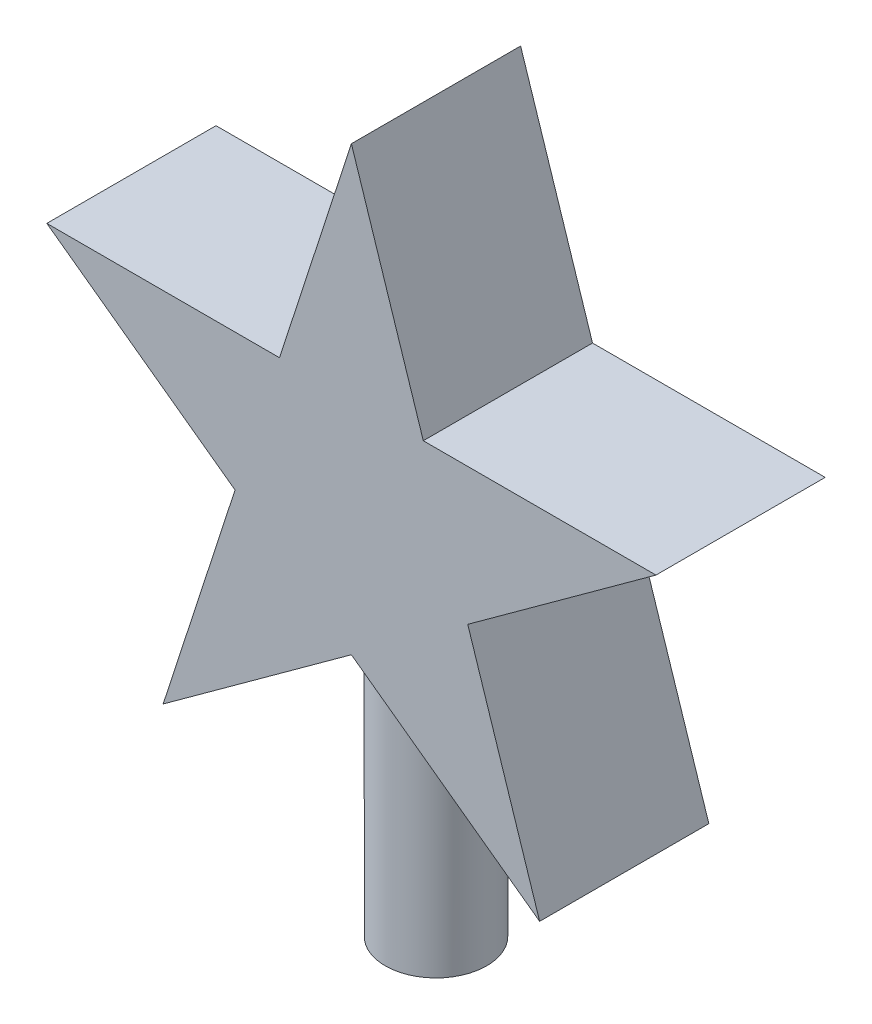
SolidWorks part; units mm, degrees
ref_plane "前视基准面" through (0, 0, 0) normal (0, 0, 1) x (1, 0, 0)
ref_plane "上视基准面" through (0, 0, 0) normal (0, 1, 0) x (1, 0, 0)
ref_plane "右视基准面" through (0, 0, 0) normal (1, 0, 0) x (0, 0, -1)
sketch "草图1" plane through (0, 0, 0) normal (0, 0, 1) x (1, 0, 0)
  line L0 (0, 0) -> (0, 31.7923) construction
  line L1 (-9, 2.9243) -> (-2.1246, 2.9243)
  line L7 (9, 2.9243) -> (3.4377, -1.117)
  line L8 (0, 9.4632) -> (-2.1246, 2.9243)
  line L9 (-9, 2.9243) -> (-3.4377, -1.117)
  line L10 (0, 9.4632) -> (2.1246, 2.9243)
  line L11 (2.1246, 2.9243) -> (9, 2.9243)
  line L12 (-3.4377, -1.117) -> (-5.5623, -7.6559)
  line L13 (0, -3.6146) -> (5.5623, -7.6559)
  line L14 (0, -3.6146) -> (-5.5623, -7.6559)
  line L15 (3.4377, -1.117) -> (5.5623, -7.6559)
  dimension "D1" = 18
extrude "凸台-拉伸9" add sketch "草图1" along normal blind 5
sketch "草图9" plane through (0, 2.9243, 0) normal (0, 1, 0) x (1, 0, 0)
  line L0 (0, -5) -> (0, 0) construction
  circle A0 centre (0, -2.5) radius 1.5
extrude "凸台-拉伸10" add sketch "草图9" against normal blind 15
